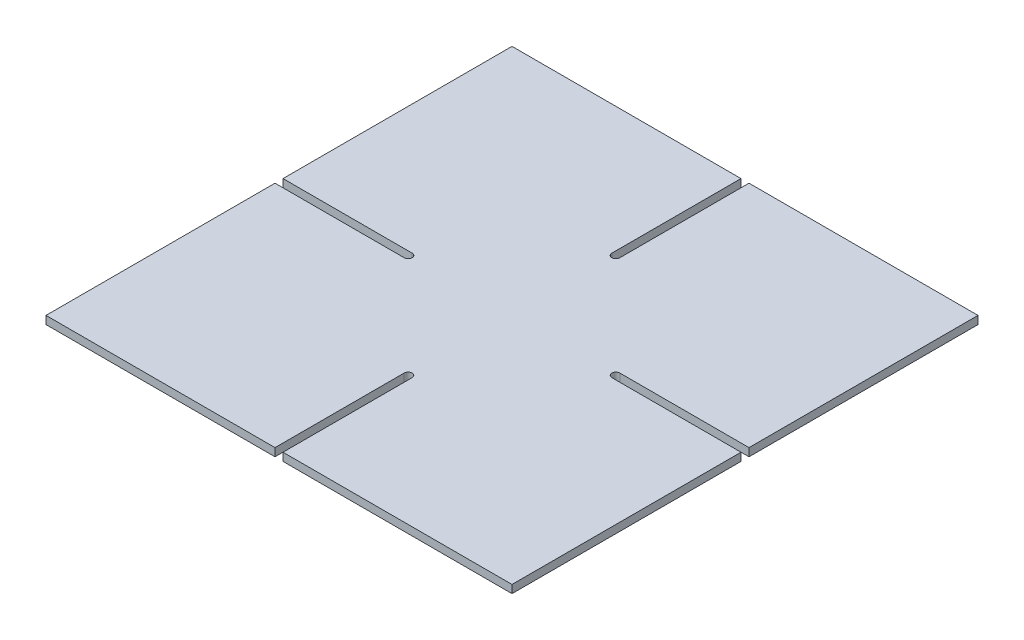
SolidWorks part; units mm, degrees
ref_plane "Alzado" through (0, 0, 0) normal (0, 0, 1) x (1, 0, 0)
ref_plane "Planta" through (0, 0, 0) normal (0, 1, 0) x (1, 0, 0)
ref_plane "Vista lateral" through (0, 0, 0) normal (1, 0, 0) x (0, 0, -1)
sketch "Croquis1" plane through (0, 0, 0) normal (0, 1, 0) x (1, 0, 0)
  line L1 (-175, -175) -> (175, -175)
  line L2 (-175, -175) -> (-175, 175)
  line L3 (-175, 175) -> (175, 175)
  line L4 (175, -175) -> (175, 175)
  line L5 (-175, -175) -> (175, 175) construction
  line L6 (-175, 175) -> (175, -175) construction
  point P0 (0, 0)
  dimension "D1" = 350
  dimension "D2" = 350
extrude "Saliente-Extruir1" add sketch "Croquis1" along normal blind 6
sketch "Croquis2" plane through (0, 6, 0) normal (0, 1, 0) x (1, 0, 0)
  line L0 (0, 175) -> (0, 75) construction
  line L1 (175, 175) -> (-175, 175) construction
  line L2 (0, -175) -> (0, -75) construction
  line L3 (-175, -175) -> (175, -175) construction
  line L4 (-175, 0) -> (-75, 0) construction
  line L5 (-175, 175) -> (-175, -175) construction
  line L6 (175, 0) -> (75, 0) construction
  line L7 (175, -175) -> (175, 175) construction
  line L8 (-3, 175) -> (-3, 78)
  line L9 (-175, -3) -> (-78, -3)
  line L10 (175, 3) -> (78, 3)
  line L11 (3, -175) -> (3, -78)
  line L12 (3, 175) -> (3, 78)
  line L13 (-175, 3) -> (-78, 3)
  line L14 (175, -3) -> (78, -3)
  line L15 (-3, -175) -> (-3, -78)
  line L16 (-3, 175) -> (3, 175)
  line L17 (175, 3) -> (175, -3)
  line L18 (3, -175) -> (-3, -175)
  line L19 (-175, 3) -> (-175, -3)
  line L20 (-175, 3) -> (-75, 3) construction
  line L21 (-175, -3) -> (-75, -3) construction
  line L22 (-3, -175) -> (-3, -75) construction
  line L23 (3, -175) -> (3, -75) construction
  line L24 (175, 3) -> (75, 3) construction
  line L25 (175, -3) -> (75, -3) construction
  line L26 (-3, 175) -> (-3, 75) construction
  line L27 (3, 175) -> (3, 75) construction
  arc A0 (-3, 78) -> (3, 78) centre (0, 78) ccw
  arc A1 (78, 3) -> (78, -3) centre (78, 0) ccw
  arc A2 (3, -78) -> (-3, -78) centre (0, -78) ccw
  arc A3 (-78, -3) -> (-78, 3) centre (-78, 0) ccw
  point P33 (0, 78)
  point P36 (78, 0)
  point P39 (0, -78)
  point P42 (-78, 0)
  dimension "D1" = 100
  dimension "D2" = 100
  dimension "D3" = 100
  dimension "D4" = 100
  dimension "D7" = 3
  dimension "D8" = 3
  dimension "D9" = 3
  dimension "D10" = 3
  dimension "D5" = 3
  dimension "D6" = 3
extrude "Cortar-Extruir1" cut sketch "Croquis2" against normal blind 40
